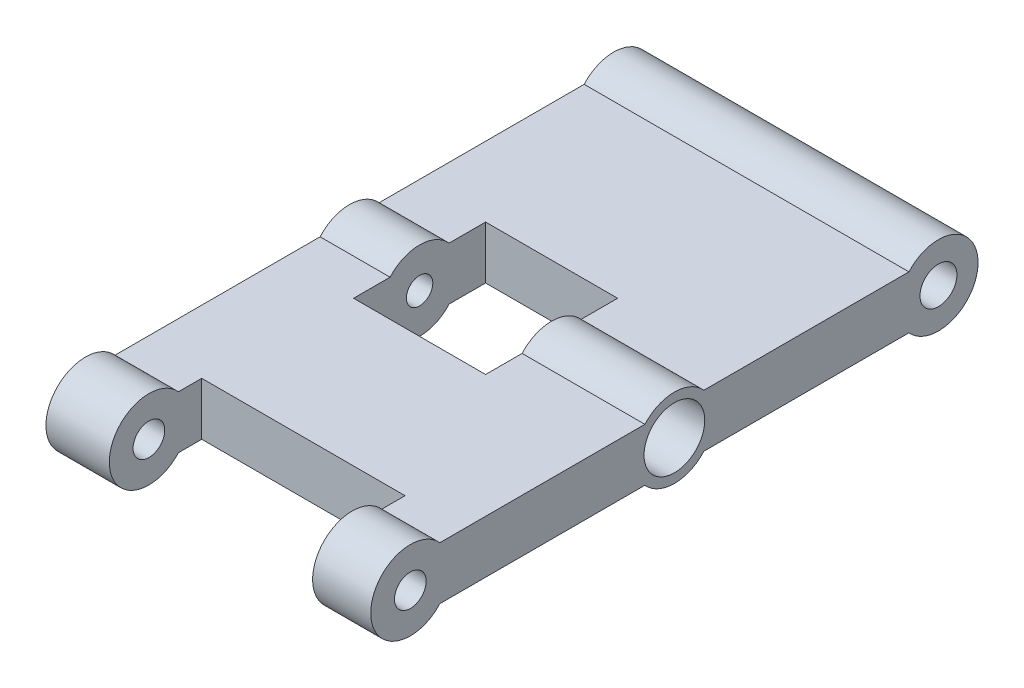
SolidWorks part; units mm, degrees
ref_plane "Front Plane" through (0, 0, 0) normal (0, 0, 1) x (1, 0, 0)
ref_plane "Top Plane" through (0, 0, 0) normal (0, 1, 0) x (1, 0, 0)
ref_plane "Right Plane" through (0, 0, 0) normal (1, 0, 0) x (0, 0, -1)
sketch "Sketch1" plane through (0, 0, 0) normal (1, 0, 0) x (0, 0, -1)
  line L1 (0, 0) -> (50.8, 0)
  line L2 (0, 0) -> (0, 5.08)
  line L3 (0, 5.08) -> (50.8, 5.08)
  line L4 (50.8, 0) -> (50.8, 5.08)
  dimension "D1" = 5.08
  dimension "D2" = 50.8
extrude "Boss-Extrude1" add sketch "Sketch1" along normal blind 31.242
sketch "Sketch2" plane through (31.242, 0, 0) normal (1, 0, 0) x (0, 0, -1)
  line L0 (0, 5.08) -> (0, 0) construction
  line L1 (50.8, 0) -> (50.8, 5.08) construction
  circle A0 centre (0, 2.54) radius 3.81
  circle A1 centre (50.8, 2.54) radius 3.81
  dimension "D1" = 7.62
  dimension "D2" = 7.62
extrude "Boss-Extrude2" add sketch "Sketch2" against normal blind 31.242
sketch "Sketch3" plane through (0, 5.08, 0) normal (0, 1, 0) x (1, 0, 0)
  line L0 (0, 47.9602) -> (0, 2.8398) construction
  line L1 (6.096, 5.08) -> (25.654, 5.08)
  line L2 (6.096, 5.08) -> (6.096, -8.6313)
  line L3 (6.096, -8.6313) -> (25.654, -8.6313)
  line L4 (25.654, 5.08) -> (25.654, -8.6313)
  line L5 (0, -3.81) -> (31.242, -3.81) construction
  dimension "D1" = 19.558
  dimension "D2" = 6.096
  dimension "D3" = 8.89
extrude "Cut-Extrude1" cut sketch "Sketch3" against normal mid plane 31.75
sketch "Sketch4" plane through (0, 5.08, 0) normal (0, 1, 0) x (1, 0, 0)
  line L0 (-3.3841, 25.4) -> (39.1226, 25.4) construction
  line L2 (6.731, 31.75) -> (19.431, 31.75)
  line L3 (6.731, 31.75) -> (6.731, 19.05)
  line L4 (6.731, 19.05) -> (19.431, 19.05)
  line L5 (19.431, 31.75) -> (19.431, 19.05)
  line L6 (15.621, 56.2152) -> (15.621, -6.3549) construction
  dimension "D1" = 25.4
  dimension "D3" = 12.7
  dimension "D4" = 12.7
  dimension "D5" = 6.35
  dimension "D6" = 3.81
sketch "Sketch5" plane through (0, 0, 0) normal (-1, 0, 0) x (0, 0, 1)
  line L0 (-47.9602, 5.08) -> (-2.8398, 5.08) construction
  circle A0 centre (-25.4, 2.54) radius 1.27
  dimension "D1" = 2.54
  dimension "D2" = 2.54
sketch "Sketch6" plane through (0, 0, 0) normal (-1, 0, 0) x (0, 0, 1)
  circle A0 centre (-50.8, 2.54) radius 1.778
  circle A2 centre (0, 2.54) radius 1.524
  dimension "D1" = 3.556
  dimension "D2" = 3.048
extrude "Cut-Extrude4" cut sketch "Sketch6" against normal through all
sketch "Sketch7" plane through (0, 0, 0) normal (-1, 0, 0) x (0, 0, 1)
  circle A0 centre (-25.4, 2.54) radius 3.81
  arc A1 (-47.9602, 5.08) -> (-47.9602, 0) centre (-50.8, 2.54) ccw construction
extrude "Boss-Extrude3" add sketch "Sketch7" against normal up to surface (31.242 mm away)
extrude "Cut-Extrude5" cut sketch "Sketch5" against normal through all
extrude "Cut-Extrude6" cut sketch "Sketch4" against normal through all both and the other way through all
sketch "Sketch8" plane through (31.242, 0, 0) normal (1, 0, 0) x (0, 0, -1)
  circle A0 centre (25.4, 2.54) radius 2.921
  dimension "D1" = 5.842
extrude "Cut-Extrude7" cut sketch "Sketch8" against normal offset from surface (9.271 mm away) 2.54
sketch "Sketch9" plane through (0, 0, 0) normal (-1, 0, 0) x (0, 0, 1)
  circle A0 centre (-25.4, 2.54) radius 2.921
  dimension "D1" = 5.842
extrude "Cut-Extrude8" cut sketch "Sketch9" against normal offset from surface (4.191 mm away) 2.54
